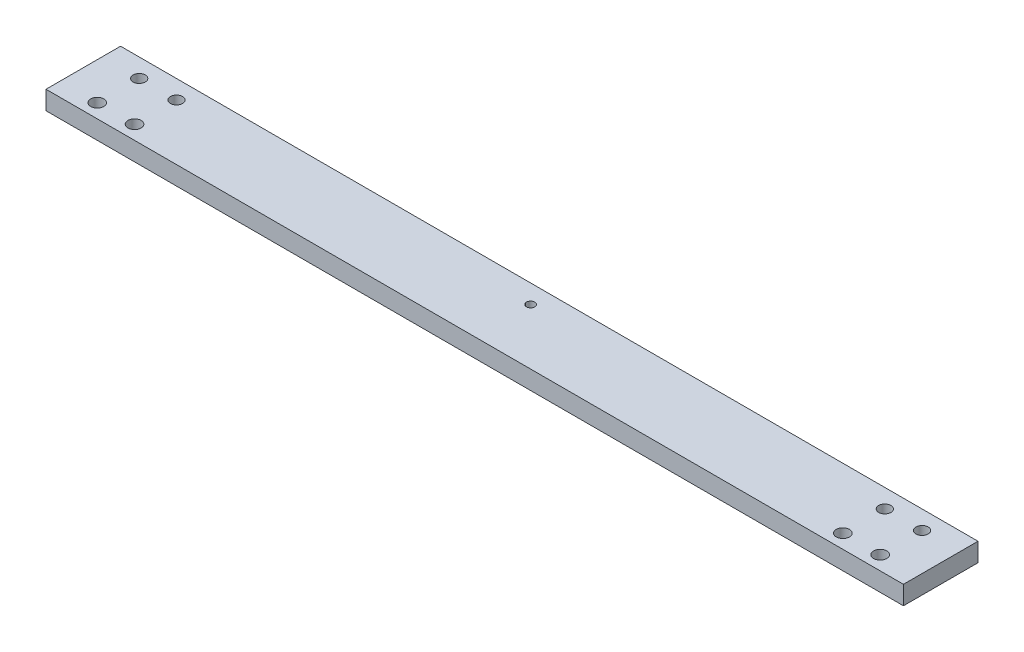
SolidWorks part; units mm, degrees
ref_plane "Front Plane" through (0, 0, 0) normal (0, 0, 1) x (1, 0, 0)
ref_plane "Top Plane" through (0, 0, 0) normal (0, 1, 0) x (1, 0, 0)
ref_plane "Right Plane" through (0, 0, 0) normal (1, 0, 0) x (0, 0, -1)
sketch "Sketch2" plane through (0, 0, 0) normal (0, 1, 0) x (1, 0, 0)
  line L1 (-146.05, -19.05) -> (146.05, -19.05)
  line L2 (-146.05, -19.05) -> (-146.05, 6.35)
  line L3 (-146.05, 6.35) -> (146.05, 6.35)
  line L4 (146.05, -19.05) -> (146.05, 6.35)
  point P0 (0, 0)
  dimension "D1" = 25.4
  dimension "D2" = 146.05
  dimension "D3" = 146.05
extrude "Boss-Extrude1" add sketch "Sketch2" along normal blind 6.35
sketch "Sketch4" plane through (0, 6.35, 0) normal (0, 1, 0) x (1, 0, 0)
  line L1 (-146.05, 6.35) -> (-146.05, -19.05) construction
  line L2 (-146.05, -14.2875) -> (-133.35, -14.2875) construction
  line L3 (-133.35, -14.2875) -> (-120.65, -14.2875) construction
  line L4 (-146.05, 0) -> (-133.35, 0) construction
  line L5 (-133.35, 0) -> (-120.65, 0) construction
  line L6 (0, -19.05) -> (0, 0) construction
  line L8 (-146.05, -19.05) -> (146.05, -19.05) construction
  dimension "D1" = 12.7
  dimension "D2" = 12.7
  dimension "D3" = 4.7625
  dimension "D4" = 19.05
  dimension "D5" = 12.7
  dimension "D6" = 12.7
  dimension "D7" = 19.05
hole_wizard "#8 Clearance Hole1" positions "Sketch6" profile "Sketch7" hole size "#8" standard "ANSI Inch"
sketch "Sketch6" plane through (0, 6.35, 0) normal (0, 1, 0) x (1, 0, 0)
  point P0 (-133.35, -14.2875)
  point P3 (-120.65, -14.2875)
sketch "Sketch7" plane through (-133.35, 6.35, 14.2875) normal (1, 0, 0) x (0, 0, 1)
  line L0 (0, 0) -> (0, 6.35)
  line L1 (0, 6.35) -> (2.2479, 6.35)
  line L2 (2.2479, 6.35) -> (2.2479, 0)
  line L5 (2.2479, 0) -> (0, 0)
  line L11 (0, -6.35) -> (0, 107.95) construction
  dimension "Thru Hole Dia." = 4.4958
  dimension "Thru Hole Depth" = 6.35
hole_wizard "#8-32 Tapped Hole1" positions "Sketch15" profile "Sketch14" tap size "#8-32" standard "ANSI Inch"
sketch "Sketch15" plane through (0, 6.35, 0) normal (0, 1, 0) x (1, 0, 0)
  point P0 (-133.35, 0)
  point P3 (-120.65, 0)
sketch "Sketch14" plane through (-133.35, 6.35, 0) normal (1, 0, 0) x (0, 0, 1)
  line L0 (0, 0) -> (0, 6.35)
  line L1 (0, 6.35) -> (2.0828, 6.35)
  line L2 (2.0828, 6.35) -> (2.0828, 0)
  line L5 (2.0828, 0) -> (0, 0)
  line L11 (0, -6.35) -> (0, 107.95) construction
  dimension "Thread Major Dia." = 4.1656
  dimension "Thru Tap Drill Depth" = 6.35
mirror "Mirror1" about plane through (0, 0, 0) normal (1, 0, 0) of "#8-32 Tapped Hole1", "#8 Clearance Hole1"
hole_wizard "#4-40 Tapped Hole1" positions "Sketch17" profile "Sketch16" tap size "#4-40" standard "ANSI Inch"
sketch "Sketch17" plane through (0, 6.35, 0) normal (0, 1, 0) x (1, 0, 0)
  point P0 (0, 0)
sketch "Sketch16" plane through (0, 6.35, 0) normal (1, 0, 0) x (0, 0, 1)
  line L0 (0, 0) -> (0, 6.35)
  line L1 (0, 6.35) -> (1.4224, 6.35)
  line L2 (1.4224, 6.35) -> (1.4224, 0)
  line L5 (1.4224, 0) -> (0, 0)
  line L11 (0, -6.35) -> (0, 107.95) construction
  dimension "Thread Major Dia." = 2.8448
  dimension "Thru Tap Drill Depth" = 6.35
